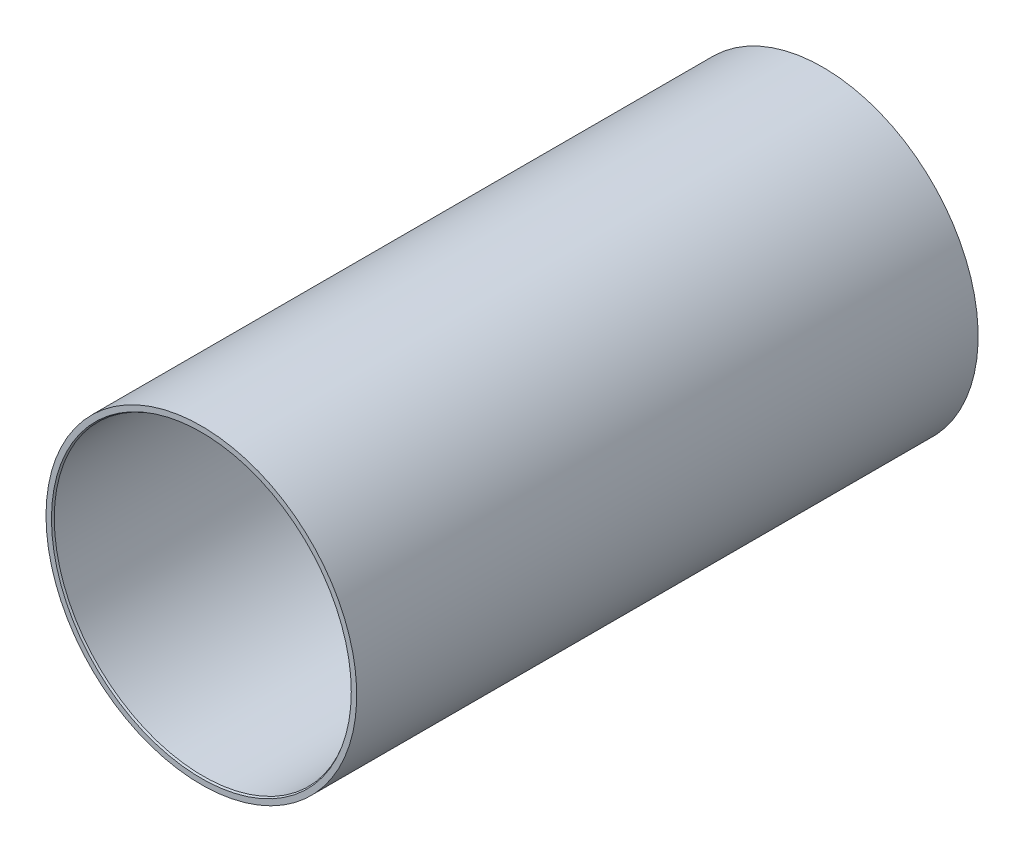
SolidWorks part; units mm, degrees
ref_plane "Front Plane" through (0, 0, 0) normal (0, 0, 1) x (1, 0, 0)
ref_plane "Top Plane" through (0, 0, 0) normal (0, 1, 0) x (1, 0, 0)
ref_plane "Right Plane" through (0, 0, 0) normal (1, 0, 0) x (0, 0, -1)
sketch "Sketch1" plane through (0, 0, 0) normal (0, 0, 1) x (1, 0, 0)
  circle A0 centre (0, 0) radius 152.4
  circle A1 centre (0, 0) radius 146.05
  dimension "D1" = 304.8
  dimension "D2" = 6.35
extrude "Boss-Extrude1" add sketch "Sketch1" along normal blind 609.6
chamfer "Chamfer1" distance 1.016 angle 60 2 edges at (146.05, 0, 0) (146.05, 0, 609.6)
